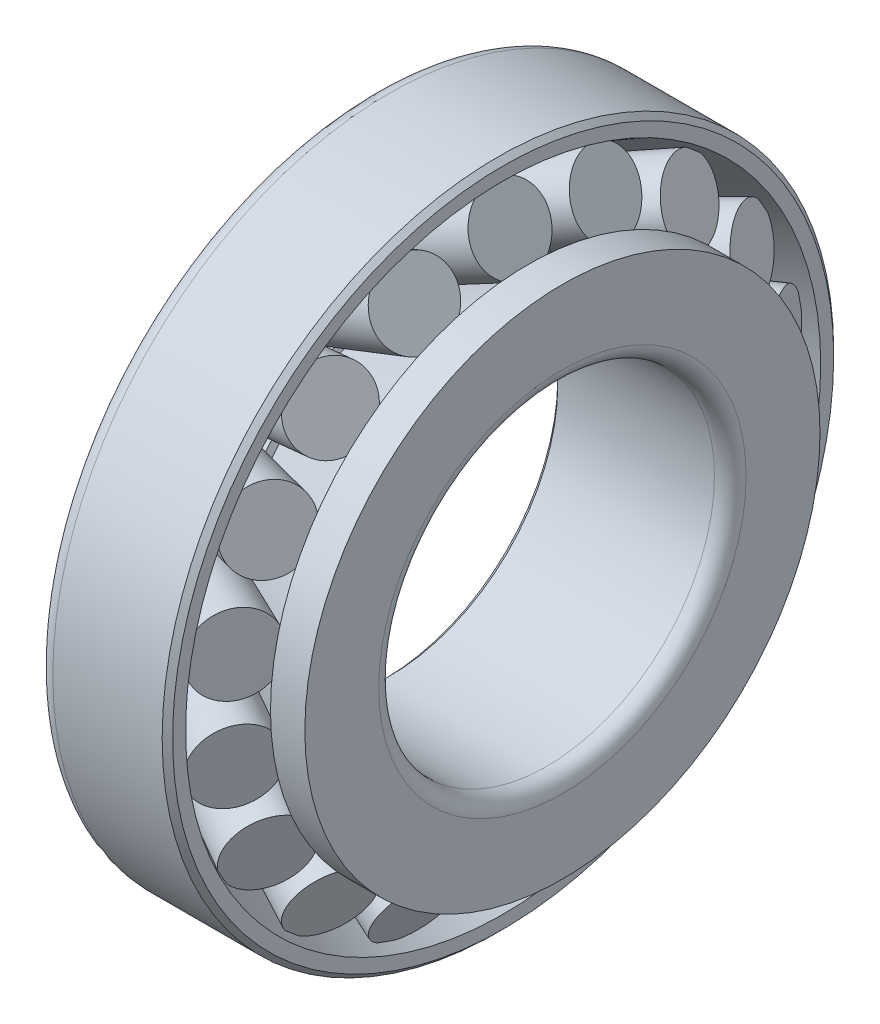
SolidWorks part; units mm, degrees
revolve "OuterRace" add sketch "OutRacSke" angle 360 about L5
sketch "OutRacSke" plane through (0, 0, 0) normal (0, 0, 1) x (1, 0, 0)
  line L0 (-15, 80.39) -> (-48, 62.814)
  line L1 (-48, 62.814) -> (-48, 81)
  line L2 (-44, 85) -> (-16.32, 85)
  line L3 (-16.32, 85) -> (-15, 83.68)
  line L4 (-15, 83.68) -> (-15, 80.39)
  line L5 (-42.5, 0) -> (42.5, 0) construction
  arc A0 (-48, 81) -> (-44, 85) centre (-44, 81) cw
ref_plane "Plane1" through (0, 0, 0) normal (0, 0, 1) x (1, 0, 0)
ref_plane "Plane2" through (0, 0, 0) normal (0, 1, 0) x (1, 0, 0)
ref_plane "Plane3" through (0, 0, 0) normal (1, 0, 0) x (0, 0, -1)
other "Configuration Table"
sketch "Clipboard" plane through (0, 0, 0) normal (0, 0, 1) x (1, 0, 0)
  line L0 (0, 0) -> (10, 0) construction
  line L1 (0, 0) -> (119.4793, -38.8212)
  line L2 (0, 0) -> (73.6122, 42.5)
  line L3 (0, 0) -> (147.2243, -85)
  line L4 (0, 0) -> (-29.6819, -1.0365)
  line L5 (0, 0) -> (-19.25, 48)
sketch "RolDetSke" plane through (0, 0, 0) normal (0, 0, 1) x (1, 0, 0)
  line L0 (-39.4754, 56.7739) -> (-44, 65.2691)
  line L1 (-39.4754, 56.7739) -> (-13.2616, 70.7355)
  line L2 (-17.7862, 79.2308) -> (-13.2616, 70.7355)
  line L4 (-49.0629, 51.6676) -> (-2.2918, 76.5781) construction
  line L5 (-17.7862, 79.2308) -> (-44, 65.2691)
  line L9 (-15, 80.39) -> (-48, 62.814) construction
revolve "RollerDetailed" add sketch "RolDetSke" angle 360 about L4
sketch "RolSimSke" plane through (0, 0, 0) normal (0, 0, 1) x (1, 0, 0)
  line L0 (0, 0) -> (-32, 0) construction
  line L1 (-44, 65.2691) -> (-17.7862, 79.2308)
  line L2 (-44, 65.2691) -> (-34.9508, 48.2787)
  line L3 (-34.9508, 48.2787) -> (-8.737, 62.2403)
  line L4 (-17.7862, 79.2308) -> (-8.737, 62.2403)
revolve "RollersSimplified" [suppressed] add sketch "RolSimSke" angle 360 about L0
ref_axis "Axis1" through (-50, 0, 0) along (1, 0, 0)
pattern_circular "RollersDetailed" count 18 every 20 about axis through (-50, 0, 0) along (1, 0, 0) of "RollerDetailed", "OuterRace"
sketch "InsRacSke" plane through (0, 0, 0) normal (0, 0, 1) x (1, 0, 0)
  line L0 (-35.6965, 49.7637) -> (-45, 49.7637)
  line L1 (-48, 81) -> (-48, -81) construction
  line L2 (-45, 49.7637) -> (-45, 43.82)
  line L3 (-45, 43.82) -> (-43.68, 42.5)
  line L4 (-43.68, 42.5) -> (-4, 42.5)
  line L5 (0, 46.5) -> (0, 65.2103)
  line L6 (0, 65.2103) -> (-8.6918, 65.2103)
  line L7 (-8.6918, 65.2103) -> (-8.6918, 62.2403)
  line L8 (-8.6918, 62.2403) -> (-34.9056, 48.2787)
  line L9 (-34.9056, 48.2787) -> (-35.6965, 49.7637)
  line L10 (-42.5, 0) -> (42.5, 0) construction
  arc A0 (-4, 42.5) -> (0, 46.5) centre (-4, 46.5) ccw
revolve "InnerRace" add sketch "InsRacSke" angle 360 about L10
sketch "CagSpiSke" plane through (0, 0, 0) normal (0, 0, 1) x (1, 0, 0)
  line L3 (-11.9509, 71.1089) -> (-39.4754, 56.4492)
  line L4 (-40.0048, 54.7132) -> (-38.7983, 52.4478)
  line L6 (-42.5, 0) -> (42.5, 0) construction
  arc A1 (-39.4754, 56.4492) -> (-40.0048, 54.7132) centre (-38.8721, 55.3165) ccw
revolve "CageSpine" [suppressed] add sketch "CagSpiSke" angle 360 about L6
equation "\"OD@OutRacSke\" =  \"Race_OD@Clipboard\""
equation "\"cup_SID@OutRacSke\" =  \"Race_ID@Clipboard\""
equation "\"chamfer@OutRacSke\" =  \"cup_width@OutRacSke\" / 25"
equation "\"offset@OutRacSke\" =  \"OA_width@Clipboard\""
equation "\"D2@RolDetSke\" =  \"offset@OutRacSke\" - \"cup_radius@OutRacSke\""
equation "\"dy@RolDetSke\" =  ( ( \"Race_ID@Clipboard\" / 2 ) + ( \"cup_radius@OutRacSke\" ) * tan(\"Tangle@OutRacSke\" * 3.141592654/180) ) * 1.005"
equation "\"cyl_len@RolDetSke\" =  \"cyl_len@Clipboard\""
equation "\"Roller_diameter@RolDetSke\" =  \"Roller_diameter@Clipboard\""
equation "\"dx@RolSimSke\" =  \"offset@OutRacSke\" - \"cup_radius@OutRacSke\""
equation "\"dy@RolSimSke\" =  ( ( \"Race_ID@Clipboard\" / 2 ) + ( \"cup_radius@OutRacSke\" ) * tan(\"Tangle@OutRacSke\" * 3.141592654/180) ) * 1.005"
equation "\"Cyl_Len@RolSimSke\" =  \"cyl_len@Clipboard\""
equation "\"Roller_diameter@RolSimSke\" =  \"Roller_diameter@Clipboard\""
equation "\"Bore@InsRacSke\" =  \"Bore@Clipboard\""
equation "\"Tangle@InsRacSke\" =  \"Tangle@OutRacSke\""
equation "\"cyl_len@InsRacSke\" =  \"cyl_len@Clipboard\""
equation "\"chamfer@InsRacSke\" =  \"chamfer@OutRacSke\""
equation "\"D2@InsRacSke\" =  \"OA_width@Clipboard\""
equation "\"dx@InsRacSke\" =  \"offset@OutRacSke\" - \"cup_radius@OutRacSke\" -  (  \"Roller_diameter@Clipboard\" * 1.005 )  * sin(\"Tangle@InsRacSke\" * 3.141592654/180)"
equation "\"dy@InsRacSke\" =  ( ( \"Race_ID@Clipboard\" / 2 ) + ( \"cup_radius@OutRacSke\" ) * tan(\"Tangle@OutRacSke\" * 3.141592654/180) ) * 1.005 -  ( \"Roller_diameter@Clipboard\" )  * cos(\"Tangle@InsRacSke\" * 3.1415"
equation "\"front_groove@InsRacSke\" =  \"Groove_dp@InsRacSke\" / 2"
equation "\"Tangle@CagSpiSke\" =  \"Tangle@OutRacSke\""
equation "\"dx@CagSpiSke\" =  ( \"offset@OutRacSke\" - \"cup_radius@OutRacSke\" ) -  (  \"Roller_diameter@Clipboard\" / 2  )  * sin(\"Tangle@InsRacSke\" * 3.141592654/180)"
equation "\"dy@CagSpiSke\" =  ( ( \"Race_ID@Clipboard\" / 2 ) + ( \"cup_radius@OutRacSke\" ) * tan(\"Tangle@OutRacSke\" * 3.141592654/180) )  -  ( \"Roller_diameter@Clipboard\" / 2 )  * cos(\"Tangle@InsRacSke\" * 3.1415926"
equation "\"length@CagSpiSke\" =  \"cyl_len@Clipboard\" * 1.05"
equation "\"offset@CagSpiSke\" =  \"Roller_diameter@Clipboard\" / 5"
equation "\"radius@CagSpiSke\" =  \"offset@CagSpiSke\" / 3"
equation "\"D3@CageSpine\" =  \"Roller_diameter@Clipboard\" / 6"
equation "\"Max_countClipboard_v1\" =  int( 3.14159265 / atn(( \"Roller_diameter@Clipboard\" / 2) / sqr( \"dy@CagSpiSke\"  *  \"dy@CagSpiSke\" - ( \"Roller_diameter@Clipboard\" / 2) *  ( \"Roller_diameter@Clipboard\" / 2))"
equation "\"Max_count@Clipboard\" =  ((sgn( \"Max_countClipboard_v1\" - \"Count@Clipboard\" )-1)*( \"Max_countClipboard_v1\" - \"Count@Clipboard\" ))/-2+ \"Count@Clipboard\""
equation "\"CountRollersDetailed_v1\" =  int( \"Show_count@Clipboard\" )"
equation "\"CountRollersDetailed_v2\" =  ((sgn( \"CountRollersDetailed_v1\" - \"Max_count@Clipboard\" )-1)*( \"CountRollersDetailed_v1\" - \"Max_count@Clipboard\" ))/-2+ \"Max_count@Clipboard\""
equation "\"Count@RollersDetailed\" =  ((sgn( \"CountRollersDetailed_v2\" - \"Min_count@Clipboard\" )+1)*( \"CountRollersDetailed_v2\" - \"Min_count@Clipboard\"))/2 +\"Min_count@Clipboard\""
equation "\"Angle@RollersDetailed\" =  360.0 / \"Max_count@Clipboard\""
equation "\"AngleCageSpine_v1\" =  \"Angle@RollersDetailed\" * ( \"Count@RollersDetailed\" -1 + int( \"Count@RollersDetailed\" / \"Max_count@Clipboard\" ) )  + 0.001 -  int( \"Count@RollersDetailed\" / \"Max_count@Clipboard"
equation "\"Angle@CageSpine\" =  \"AngleCageSpine_v1\" * int( \"Min_count@Clipboard\" / 2) + int(1 / \"Min_count@Clipboard\")  * 0.001"
equation "\"Tangle@RolSimSke\" =  \"Tangle@OutRacSke\""
